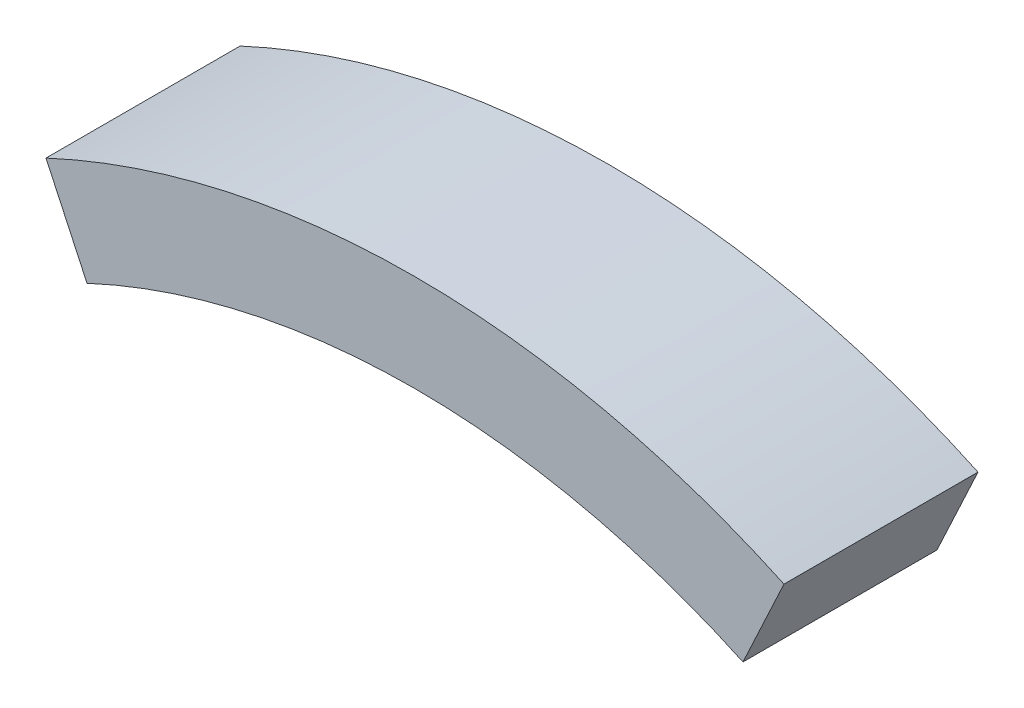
SolidWorks part; units mm, degrees
ref_plane "Plan de face" through (0, 0, 0) normal (0, 0, 1) x (1, 0, 0)
ref_plane "Plan de dessus" through (0, 0, 0) normal (0, 1, 0) x (1, 0, 0)
ref_plane "Plan de droite" through (0, 0, 0) normal (1, 0, 0) x (0, 0, -1)
sketch "Esquisse1" plane through (0, 0, 0) normal (0, 0, 1) x (1, 0, 0)
  line L0 (-19.0178, 40.7839) -> (-16.9047, 36.2523)
  line L1 (19.0178, 40.7839) -> (16.9047, 36.2523)
  line L2 (0, 62.8484) -> (0, -50.3512) construction
  arc A0 (16.9047, 36.2523) -> (-16.9047, 36.2523) centre (0, 0) ccw
  arc A1 (19.0178, 40.7839) -> (-19.0178, 40.7839) centre (0, 0) ccw
  dimension "D1" = 80
  dimension "D2" = 90
  dimension "D3" = 50
  dimension "D4" = 25
extrude "Extrusion1" add sketch "Esquisse1" along normal blind 10
